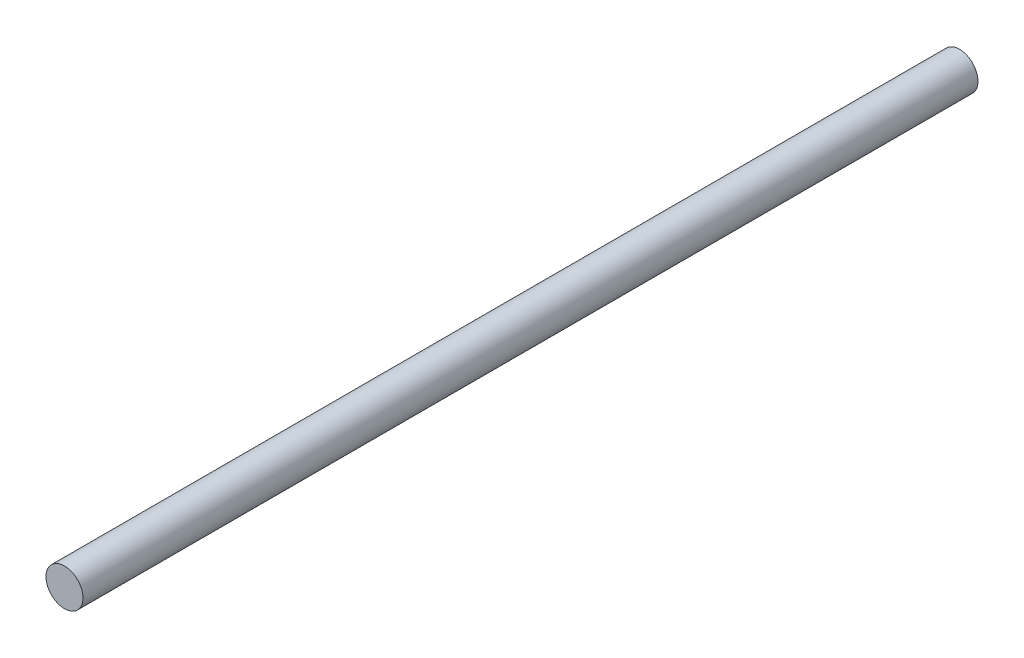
SolidWorks part; units mm, degrees
ref_plane "Front Plane" through (0, 0, 0) normal (0, 0, 1) x (1, 0, 0)
ref_plane "Top Plane" through (0, 0, 0) normal (0, 1, 0) x (1, 0, 0)
ref_plane "Right Plane" through (0, 0, 0) normal (1, 0, 0) x (0, 0, -1)
sketch "Sketch1" plane through (0, 0, 0) normal (0, 0, 1) x (1, 0, 0)
  circle A0 centre (0, 0) radius 30
  dimension "D1" = 60
extrude "Boss-Extrude1" add sketch "Sketch1" against normal blind 1450
